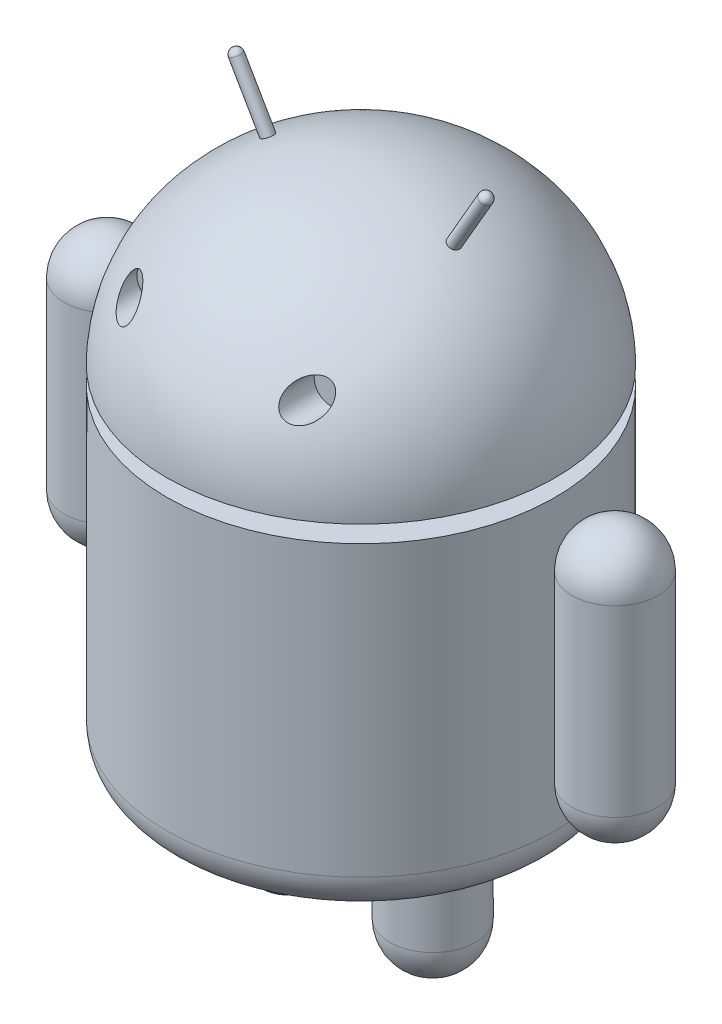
SolidWorks part; units mm, degrees
ref_plane "Front Plane" through (0, 0, 0) normal (0, 0, 1) x (1, 0, 0)
ref_plane "Top Plane" through (0, 0, 0) normal (0, 1, 0) x (1, 0, 0)
ref_plane "Right Plane" through (0, 0, 0) normal (1, 0, 0) x (0, 0, -1)
sketch "Sketch2" plane through (0, 0, 0) normal (1, 0, 0) x (0, 0, -1)
  line L0 (0, 0) -> (-39.37, 0)
  line L1 (-49.53, 10.16) -> (-49.53, 83.82)
  line L2 (-49.53, 83.82) -> (0, 83.82)
  line L3 (0, 83.82) -> (0, 0)
  line L4 (-49.53, 88.138) -> (0, 88.138)
  line L5 (0, 88.138) -> (0, 132.588)
  arc A0 (-39.37, 0) -> (-49.53, 10.16) centre (-39.37, 10.16) cw
  ellipse E0 centre (0, 88.138) end of major axis (-49.53, 88.138) minor radius 44.45 (0, 132.588) -> (-49.53, 88.138) ccw
  dimension "D4" = 10.16
  dimension "D1" = 44.45
  dimension "D2" = 49.53
  dimension "D3" = 4.318
  dimension "D5" = 83.82
  dimension "D6" = 132.588
revolve "Revolve1" add sketch "Sketch2" angle 360 about L3
sketch "Sketch3" plane through (0, 0, 0) normal (0, -1, 0) x (1, 0, 0)
  line L0 (-18.288, 0) -> (18.288, 0) construction
  circle A0 centre (-18.288, 0) radius 10.922
  circle A1 centre (18.288, 0) radius 10.922
  dimension "D1" = 21.844
  dimension "D2" = 14.732
extrude "Extrude1" add sketch "Sketch3" along normal blind 35.56
fillet "Fillet1" radius 10.922 2 edges at (18.288, -35.56, -10.922) (-18.288, -35.56, -10.922)
sketch "Sketch4" plane through (0, 0, 0) normal (0, -1, 0) x (1, 0, 0)
  line L0 (0, 0) -> (0, 49.53) construction
  circle A0 centre (0, 0) radius 49.53 construction
ref_plane "Plane1" through (0, 0, 49.53) normal (0, 0, 1) x (1, 0, 0)
sketch "Sketch5" plane through (0, 0, 49.53) normal (0, 0, 1) x (1, 0, 0)
  line L0 (0, 0) -> (0, 109.982) construction
  line L1 (-49.53, 88.138) -> (49.53, 88.138) construction
  line L3 (-22.606, 109.982) -> (22.606, 109.982) construction
  circle A0 centre (-22.606, 109.982) radius 4.064
  circle A1 centre (22.606, 109.982) radius 4.064
  dimension "D1" = 8.128
  dimension "D2" = 17.78
  dimension "D3" = 37.084
extrude "Extrude2" cut sketch "Sketch5" against normal blind 19.05
sketch "Sketch6" plane through (0, 0, 0) normal (0, 0, 1) x (1, 0, 0)
  line L0 (-64.77, 75.184) -> (-64.77, 28.448) construction
  line L1 (-53.848, 75.184) -> (-53.848, 28.448)
  line L2 (-49.53, 83.82) -> (-49.53, 10.16) construction
  line L3 (-64.77, 86.106) -> (-64.77, 17.526)
  line L4 (49.53, 83.82) -> (-49.53, 83.82) construction
  arc A0 (-53.848, 75.184) -> (-64.77, 86.106) centre (-64.77, 75.184) ccw
  arc A1 (-64.77, 17.526) -> (-53.848, 28.448) centre (-64.77, 28.448) ccw
  point P2 (-76.1674, 48.9146)
  dimension "D1" = 10.922
  dimension "D2" = 68.58
  dimension "D3" = 4.318
  dimension "D4" = 2.286
revolve "Revolve2" add sketch "Sketch6" angle 360 about L3
sketch "Sketch7" plane through (0, 0, 0) normal (0, 0, 1) x (1, 0, 0)
  line L0 (-32.5445, 142.3071) -> (-1.27, 88.138) construction
  line L1 (-49.53, 88.138) -> (49.53, 88.138) construction
  line L2 (-49.53, 88.138) -> (49.53, 88.138) construction
  line L3 (0, 0) -> (0, 88.138) construction
  line L4 (-33.1023, 140.2252) -> (-23.8313, 124.1674)
  line L5 (-23.8313, 124.1674) -> (-22.5115, 124.9294)
  line L6 (-22.5115, 124.9294) -> (-32.5445, 142.3071)
  arc A0 (-32.5445, 142.3071) -> (-33.1023, 140.2252) centre (-31.7825, 140.9872) ccw
  ellipse E0 centre (0, 88.138) end of major axis (49.53, 88.138) minor radius 44.45 (49.53, 88.138) -> (0, 132.588) ccw
  ellipse E1 centre (0, 88.138) end of major axis (-49.53, 88.138) minor radius 44.45 (0, 132.588) -> (-49.53, 88.138) ccw
  ellipse E2 centre (0, 88.138) end of major axis (-49.53, 88.138) minor radius 44.45 (0, 132.588) -> (-49.53, 88.138) ccw construction
  point P26 (-23.7815, 127.1291)
  dimension "D1" = 1.27
  dimension "D2" = 60
  dimension "D3" = 2.54
  dimension "D4" = 1.524
  dimension "D5" = 17.526
revolve "Revolve3" add sketch "Sketch7" angle 360 about L6
mirror "Mirror5" about plane through (0, 0, 0) normal (1, 0, 0)
mirror "Mirror6" about plane through (0, 0, 0) normal (1, 0, 0) of "Revolve3"
